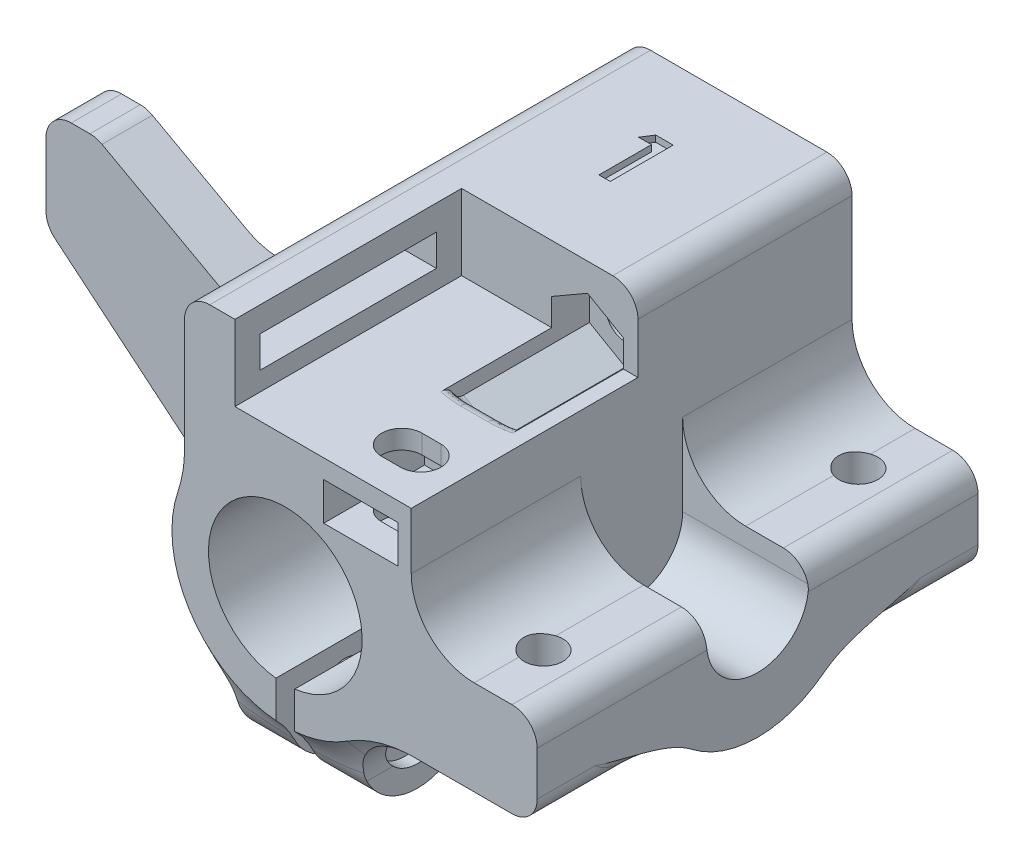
SolidWorks part; units mm, degrees
ref_plane "Спереди" through (0, 0, 0) normal (0, 0, 1) x (1, 0, 0)
ref_plane "Сверху" through (0, 0, 0) normal (0, 1, 0) x (1, 0, 0)
ref_plane "Справа" through (0, 0, 0) normal (1, 0, 0) x (0, 0, -1)
sketch "Эскиз1" plane through (0, 0, 0) normal (0, 0, 1) x (1, 0, 0)
  line L0 (0, 0) -> (0, 21.6321) construction
  line L1 (0, 0) -> (26.3176, 0) construction
  line L2 (18, -6) -> (10.247, -6)
  line L3 (-8, 15) -> (-8, 6.0828)
  line L4 (-6, 17) -> (8, 17)
  line L5 (10, 15) -> (10, 6.5)
  line L6 (15, 1.5) -> (18, 1.5)
  line L7 (20, -4) -> (20, -0.5)
  arc A0 (-8.5263, 2.8813) -> (-8, 6.0828) centre (-18, 6.0828) ccw
  arc A1 (-8.5263, 2.8813) -> (4.8538, -7.5789) centre (0, 0) ccw
  arc A2 (10.247, -6) -> (4.8538, -7.5789) centre (10.247, -16) ccw
  arc A4 (18, -6) -> (20, -4) centre (18, -4) ccw
  arc A5 (20, -0.5) -> (18, 1.5) centre (18, -0.5) ccw
  arc A6 (8, 17) -> (10, 15) centre (8, 15) cw
  arc A7 (-6, 17) -> (-8, 15) centre (-6, 15) ccw
  arc A8 (10, 6.5) -> (15, 1.5) centre (15, 6.5) ccw
  dimension "D2" = 10
  dimension "D4" = 2
  dimension "D5" = 5
  dimension "D6" = 9
  dimension "D12" = 2
  dimension "D13" = 10
  dimension "D3" = 6
  dimension "D7" = 17
  dimension "D8" = 8
  dimension "D9" = 10
  dimension "D10" = 20
  dimension "D11" = 1.5
extrude "Бобышка-Вытянуть1" add sketch "Эскиз1" along normal blind 35
sketch "Эскиз2" plane through (20, 0, 0) normal (1, 0, 0) x (0, 0, -1)
  line L1 (-21.55, 0) -> (-21.55, 6.5)
  line L2 (-35, 6.5) -> (0, 6.5) construction
  line L3 (-21.55, 6.5) -> (-13.45, 6.5)
  line L4 (-13.45, 6.5) -> (-13.45, 0)
  line L5 (0, 0) -> (-35, 0) construction
  line L6 (-35, -4) -> (-35, -0.5) construction
  arc A0 (-21.55, 0) -> (-13.45, 0) centre (-17.5, 0) ccw
  dimension "D1" = 8.1
extrude "Вырез-Вытянуть1" cut sketch "Эскиз2" against normal blind 10
sketch "Эскиз26" plane through (20, 0, 0) normal (1, 0, 0) x (0, 0, -1)
  line L0 (-25.9853, -0.5) -> (-21.519, -0.5)
  line L2 (-13.481, -0.5) -> (-9.0147, -0.5)
  line L3 (-13.481, -0.5) -> (0, -0.5) construction
  arc A0 (-25.9853, -0.5) -> (-9.0147, -0.5) centre (-17.5, 0) ccw
  arc A2 (-21.519, -0.5) -> (-13.481, -0.5) centre (-17.5, 0) ccw
  arc A3 (-21.55, 0) -> (-13.45, 0) centre (-17.5, 0) ccw construction
  dimension "D1" = 17
extrude "Бобышка-Вытянуть6" add sketch "Эскиз26" against normal up to surface (11.0139 mm away)
fillet "Скругление16" radius 5 7 edges at (19.7252, -5.0118, 10.6348) (19.1945, -5.6041, 23.8909) (14.1235, -6, 11.4792) (14.1235, -6, 23.5208) (13.1009, -6.4159, 11.9245) (8.8108, -6.1037, 11.5843) (2.96, -8.4993, 17.6088)
sketch "Эскиз3" plane through (0, 0, 35) normal (0, 0, 1) x (1, 0, 0)
  line L0 (10, 15) -> (10, 11)
  line L3 (10, 11) -> (-4, 11)
  line L4 (-4, 17) -> (-4, 11)
  line L5 (8, 17) -> (-6, 17) construction
  line L6 (-4, 17) -> (8, 17)
  line L7 (10, 6.5) -> (10, 15) construction
  line L10 (0, 0) -> (0, 11.8) construction
  arc A1 (10, 15) -> (8, 17) centre (8, 15) ccw construction
  arc A2 (10, 15) -> (8, 17) centre (8, 15) ccw
  dimension "D1" = 14
  dimension "D3" = 11
extrude "Вырез-Вытянуть2" cut sketch "Эскиз3" against normal blind 18
sketch "Эскиз5" plane through (0, 0, 0) normal (0, 0, -1) x (-1, 0, 0)
  line L0 (0, 0) -> (0, 21.6564) construction
  line L1 (-7.2, 15.7) -> (3.6, 15.7)
  line L2 (-8.2, 14.7) -> (-8.2, 8.3)
  line L3 (-7.2, 7.3) -> (3.6, 7.3)
  line L4 (4.6, 14.7) -> (4.6, 8.3)
  line L6 (-8.2, 11.5) -> (4.6, 11.5) construction
  arc A0 (3.6, 15.7) -> (4.6, 14.7) centre (3.6, 14.7) cw
  arc A1 (3.6, 7.3) -> (4.6, 8.3) centre (3.6, 8.3) ccw
  arc A2 (-8.2, 8.3) -> (-7.2, 7.3) centre (-7.2, 8.3) ccw
  arc A3 (-7.2, 15.7) -> (-8.2, 14.7) centre (-7.2, 14.7) ccw
  point P6 (4.6, 15.7)
  point P13 (-8.2, 15.7)
  dimension "D2" = 1
  dimension "D1" = 12.8
  dimension "D3" = 8.4
  dimension "D4" = 11.5
  dimension "D5" = 8.2
extrude "Вырез-Вытянуть4" cut sketch "Эскиз5" against normal blind 12
ref_plane "Плоскость2" [suppressed] through (0, 0, 25) normal (0, 0, 1) x (1, 0, 0)
sketch "Эскиз6" plane through (0, 0, 25) normal (0, 0, -1) x (-1, 0, 0)
  line L0 (-7, 11.5) -> (4.6, 11.5) construction
  line L2 (4.6, 8.3) -> (4.6, 14.7) construction
  line L3 (0, 0) -> (0, 20.3496) construction
  circle A0 centre (-6, 11.5) radius 1.55
  dimension "D1" = 3.1
  dimension "D2" = 6
extrude "Вырез-Вытянуть5" cut sketch "Эскиз6" along normal through all
sketch "Эскиз7" plane through (0, 0, 25) normal (0, 0, 1) x (1, 0, 0)
  line L1 (6, 8.2091) -> (8.85, 9.8546)
  line L2 (8.85, 9.8546) -> (8.85, 13.1454)
  line L3 (8.85, 13.1454) -> (6, 14.7909)
  line L4 (6, 14.7909) -> (3.15, 13.1454)
  line L5 (3.15, 13.1454) -> (3.15, 9.8546)
  line L6 (3.15, 9.8546) -> (6, 8.2091)
  circle A0 centre (6, 11.5) radius 2.85 construction
  dimension "D1" = 5.7
extrude "Вырез-Вытянуть6" cut sketch "Эскиз7" against normal blind 11
sketch "Эскиз9" plane through (0, 17, 0) normal (0, 1, 0) x (1, 0, 0)
  line L0 (-6, -17.5) -> (20, -17.5) construction
  line L1 (8, 0) -> (-6, 0) construction
  line L3 (0, 0) -> (0, -35) construction
  line L4 (-4, -35) -> (-6, -35) construction
  circle A0 centre (15.5, -5) radius 1.55
  circle A1 centre (15.5, -30) radius 1.55
  dimension "D1" = 3.1
  dimension "D3" = 15.5
  dimension "D2" = 25
  dimension "D4" = 17.5
extrude "Вырез-Вытянуть8" cut sketch "Эскиз9" against normal through all
sketch "Эскиз10" plane through (0, -6, 0) normal (0, -1, 0) x (1, 0, 0)
  line L0 (-9, 17.5) -> (23.6847, 17.5) construction
  line L1 (12.7, 28.3834) -> (15.5, 26.7668)
  line L2 (15.5, 26.7668) -> (18.3, 28.3834)
  line L3 (18.3, 28.3834) -> (18.3, 31.6166)
  line L4 (18.3, 31.6166) -> (15.5, 33.2332)
  line L5 (15.5, 33.2332) -> (12.7, 31.6166)
  line L6 (12.7, 31.6166) -> (12.7, 28.3834)
  line L7 (-9, 35) -> (-9, 0) construction
  line L8 (12.7, 3.3834) -> (12.7, 6.6166)
  line L9 (15.5, 1.7668) -> (12.7, 3.3834)
  line L10 (18.3, 3.3834) -> (15.5, 1.7668)
  line L11 (18.3, 6.6166) -> (18.3, 3.3834)
  line L12 (15.5, 8.2332) -> (18.3, 6.6166)
  line L13 (12.7, 6.6166) -> (15.5, 8.2332)
  circle A0 centre (15.5, 30) radius 2.8 construction
  circle A1 centre (15.5, 5) radius 2.8 construction
  dimension "D1" = 5.6
extrude "Вырез-Вытянуть9" cut sketch "Эскиз10" against normal blind 3
sketch "Эскиз13" plane through (0, 0, 0) normal (0, 0, -1) x (-1, 0, 0)
  circle A0 centre (-6, 11.5) radius 2.85
  dimension "D1" = 5.7
extrude "Вырез-Вытянуть10" cut sketch "Эскиз13" against normal up to surface (12 mm away)
fillet "Скругление3" radius 1 2 edges at (8.2, 13.3118, 6) (8.2, 9.6882, 6)
sketch "Эскиз16" plane through (0, 0, 0) normal (1, 0, 0) x (0, 0, -1)
  line L0 (0, 0) -> (-35, 0) construction
  line L1 (-17.5, -4.05) -> (-17.5, 5.7469) construction
  line L2 (-35, -9) -> (0, -9) construction
  line L3 (-35, 1.5) -> (-35, -0.5) construction
  circle A0 centre (-29.5, -9) radius 1.55 construction
  circle A1 centre (-29.5, -9) radius 4.5
  circle A2 centre (-5.5, -9) radius 4.5
  circle A3 centre (-17.5, 0) radius 4.05 construction
  dimension "D1" = 3.1
  dimension "D2" = 24
  dimension "D3" = 9
extrude "Бобышка-Вытянуть4" add sketch "Эскиз16" along normal mid plane 10
fillet "Скругление7" radius 7 2 edges at (0.4549, -8.9885, 10) (-0.4549, -8.9885, 25)
fillet "Скругление9" radius 7 4 edges at (0.2249, -8.9972, 34) (-0.4549, -8.9885, 1)
fillet "Скругление11" radius 5 4 edges at (-5, -7.4833, 26.9178) (5, -7.4871, 29.5794) (5, -7.4871, 5.4206) (-5, -7.4833, 8.0822)
sketch "Эскиз15" plane through (0, 0, 35) normal (0, 0, 1) x (1, 0, 0)
  circle A0 centre (0, 0) radius 6.1
  dimension "D1" = 12.2
extrude "Вырез-Вытянуть11" cut sketch "Эскиз15" against normal through all
sketch "Эскиз18" plane through (0, 0, 35) normal (0, 0, 1) x (1, 0, 0)
  line L0 (-5, -13.5) -> (5, -13.5) construction
  line L1 (-0.75, 0) -> (0.75, 0)
  line L2 (-0.75, 0) -> (-0.75, -13.5)
  line L3 (-0.75, -13.5) -> (0.75, -13.5)
  line L4 (0.75, 0) -> (0.75, -13.5)
  point P6 (0, 0)
  dimension "D1" = 1.5
extrude "Вырез-Вытянуть13" cut sketch "Эскиз18" against normal through all
ref_plane "Плоскость1" through (-10, 0, 0) normal (1, 0, 0) x (0, 0, -1)
sketch "Эскиз17" plane through (20, 0, 0) normal (1, 0, 0) x (0, 0, -1)
  line L0 (-17.5, -4.05) -> (-17.5, 18.0703) construction
  circle A0 centre (-29.5, -9) radius 1.575
  circle A1 centre (-5.5, -9) radius 1.575
  arc A3 (-21.55, 0) -> (-13.45, 0) centre (-17.5, 0) ccw construction
  dimension "D1" = 3.15
extrude "Вырез-Вытянуть12" cut sketch "Эскиз17" against normal through all
sketch "Эскиз19" plane through (-10, 0, 0) normal (1, 0, 0) x (0, 0, -1)
  line L0 (-17.5, -8.9687) -> (-17.5, 18.2144) construction
  line L1 (-32.7332, -9) -> (-31.1166, -11.8)
  line L2 (-31.1166, -11.8) -> (-27.8834, -11.8)
  line L3 (-27.8834, -11.8) -> (-26.2668, -9)
  line L4 (-26.2668, -9) -> (-27.8834, -6.2)
  line L5 (-27.8834, -6.2) -> (-31.1166, -6.2)
  line L6 (-31.1166, -6.2) -> (-32.7332, -9)
  line L7 (-14.6666, -8.9687) -> (-20.3334, -8.9687) construction
  line L8 (-3.8834, -6.2) -> (-2.2668, -9)
  line L9 (-7.1166, -6.2) -> (-3.8834, -6.2)
  line L10 (-8.7332, -9) -> (-7.1166, -6.2)
  line L11 (-7.1166, -11.8) -> (-8.7332, -9)
  line L12 (-3.8834, -11.8) -> (-7.1166, -11.8)
  line L13 (-2.2668, -9) -> (-3.8834, -11.8)
  circle A0 centre (-29.5, -9) radius 2.8 construction
  circle A1 centre (-5.5, -9) radius 2.8 construction
  dimension "D1" = 5.6
extrude "Вырез-Вытянуть14" cut sketch "Эскиз19" along normal blind 7
sketch "Эскиз24" plane through (20, 0, 0) normal (1, 0, 0) x (0, 0, -1)
  circle A0 centre (-29.5, -9) radius 2.8
  circle A1 centre (-5.5, -9) radius 2.8
  dimension "D1" = 5.6
extrude "Вырез-Вытянуть18" cut sketch "Эскиз24" against normal blind 16
sketch "Эскиз27" plane through (-4, 0, 0) normal (1, 0, 0) x (0, 0, -1)
  line L0 (-35, 17) -> (-35, 11) construction
  line L1 (-33, 15) -> (-19, 15)
  line L2 (-33, 15) -> (-33, 12.5)
  line L3 (-33, 12.5) -> (-19, 12.5)
  line L4 (-19, 15) -> (-19, 12.5)
  line L5 (-17, 17) -> (-17, 11) construction
  line L6 (-17, 17) -> (-35, 17) construction
  dimension "D1" = 2
  dimension "D2" = 2
  dimension "D3" = 2
  dimension "D4" = 2.5
sketch "Эскиз28" plane through (0, 0, 35) normal (0, 0, 1) x (1, 0, 0)
  line L0 (6, 11.5) -> (6, -14.6324) construction
  line L1 (-4, 11) -> (10, 11) construction
  line L2 (3.05, 9.5) -> (8.95, 9.5)
  line L3 (3.05, 9.5) -> (3.05, 6.5)
  line L4 (3.05, 6.5) -> (8.95, 6.5)
  line L5 (8.95, 9.5) -> (8.95, 6.5)
  point P7 (6, 9.5)
  dimension "D1" = 5.9
  dimension "D2" = 3
  dimension "D3" = 1.5
extrude "Вырез-Вытянуть20" cut sketch "Эскиз28" against normal blind 8
sketch "Эскиз29" plane through (0, 11, 0) normal (0, 1, 0) x (1, 0, 0)
  line L0 (6, -17) -> (6, -37.7365) construction
  line L1 (6, -14) -> (6, -25) construction
  line L2 (8, -17) -> (-4, -17) construction
  line L4 (5.25, -31) -> (6.75, -31) construction
  line L5 (5.25, -29.4) -> (6.75, -29.4)
  line L6 (5.25, -32.6) -> (6.75, -32.6)
  line L7 (-4, -35) -> (10, -35) construction
  arc A1 (5.25, -29.4) -> (5.25, -32.6) centre (5.25, -31) ccw
  arc A2 (6.75, -32.6) -> (6.75, -29.4) centre (6.75, -31) ccw
  point P12 (6, -31)
  dimension "D1" = 4
  dimension "D2" = 1.6
  dimension "D3" = 1.5
extrude "Вырез-Вытянуть21" cut sketch "Эскиз29" against normal blind 6
extrude "Вырез-Вытянуть22" cut sketch "Эскиз27" against normal blind 3
fillet "Скругление17" radius 1 2 edges at (7.425, 9.0318, 25) (4.575, 9.0318, 25)
fillet "Скругление18" radius 1 3 edges at (3.158, 11, 25) (8.842, 11, 25) (6, 11, 25)
ref_plane "Плоскость3" through (0, 0, 25) normal (0, 0, 1) x (1, 0, 0)
sketch "Эскиз30" plane through (0, 0, 25) normal (0, 0, 1) x (1, 0, 0)
  line L0 (-21, 18) -> (-25, 18)
  line L1 (-25, 18) -> (-25, 10)
  line L2 (-25, 10) -> (-8, -4.1231)
  line L3 (-21, 18) -> (-8, 10.8769)
  line L4 (-8, 15) -> (-8, 6.0828) construction
  line L5 (-8, 10.8769) -> (-8, -4.1231)
  line L6 (0, 20.7474) -> (0, 0) construction
  line L7 (0, 0) -> (33.2815, 0) construction
  arc A0 (-8.5263, 2.8813) -> (-6.4286, -6.2987) centre (0, 0) ccw construction
  dimension "D1" = 8
  dimension "D2" = 4
  dimension "D3" = 25
  dimension "D4" = 18
  dimension "D5" = 15
extrude "Бобышка-Вытянуть7" add sketch "Эскиз30" along normal blind 4
fillet "Скругление19" radius 2 5 edges at (-8, -4.1231, 27) (-25, 10, 27) (-21, 18, 27) (-25, 18, 27) (-8, 10.8769, 27)
fillet "Скругление20" radius 5 3 edges at (-8.9599, -0.8483, 25) (-8.1325, 4.4605, 25) (-8, 10.168, 25)
sketch "Эскиз31" plane through (0, 17, 0) normal (0, 1, 0) x (1, 0, 0)
  text T0 "<b>1</b>" font "Century Gothic" height 5
extrude "Вырез-Вытянуть23" cut sketch "Эскиз31" against normal blind 0.5
